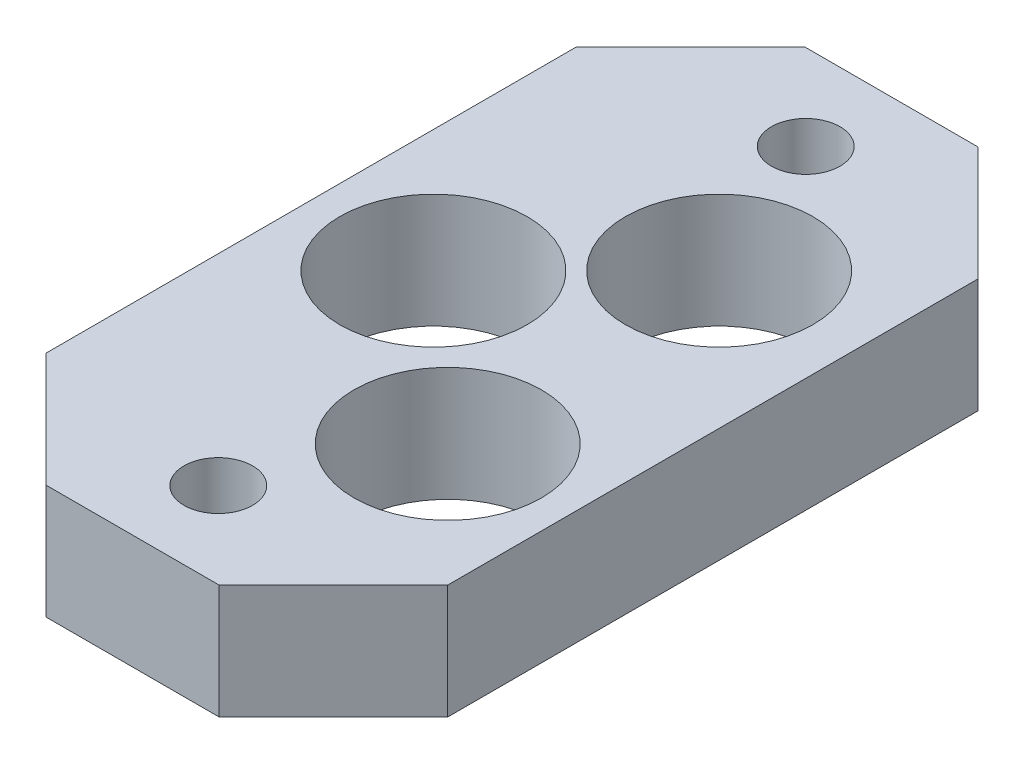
SolidWorks part; units mm, degrees
ref_plane "Front Plane" through (0, 0, 0) normal (0, 0, 1) x (1, 0, 0)
ref_plane "Top Plane" through (0, 0, 0) normal (0, 1, 0) x (1, 0, 0)
ref_plane "Right Plane" through (0, 0, 0) normal (1, 0, 0) x (0, 0, -1)
sketch "Sketch6" plane through (0, 0, 0) normal (0, 1, 0) x (1, 0, 0)
  line L0 (-37.72, 13.28) -> (-43.78, 13.28)
  line L1 (-37.72, -13.28) -> (-43.78, -13.28)
  line L2 (-47.78, 9.28) -> (-43.78, 13.28)
  line L3 (-33.72, 9.28) -> (-37.72, 13.28)
  line L5 (-47.78, -9.28) -> (-47.78, 9.28)
  line L7 (-33.72, 9.28) -> (-33.72, -9.28)
  line L9 (-33.72, -9.28) -> (-37.72, -13.28)
  line L11 (-43.78, -13.28) -> (-47.78, -9.28)
  circle A2 centre (-40.75, 10.28) radius 1.2
  circle A3 centre (-40.75, -10.28) radius 1.2
  circle A5 centre (-38.5, 5) radius 3.28
  circle A6 centre (-43.5, 0) radius 3.28
  circle A7 centre (-38, -5) radius 3.28
  point P1 (-33.72, 13.28)
  point P2 (-47.78, 13.28)
  point P3 (-33.72, -13.28)
  point P4 (-47.78, -13.28)
extrude "Boss-Extrude4" add sketch "Sketch6" along normal blind 4
